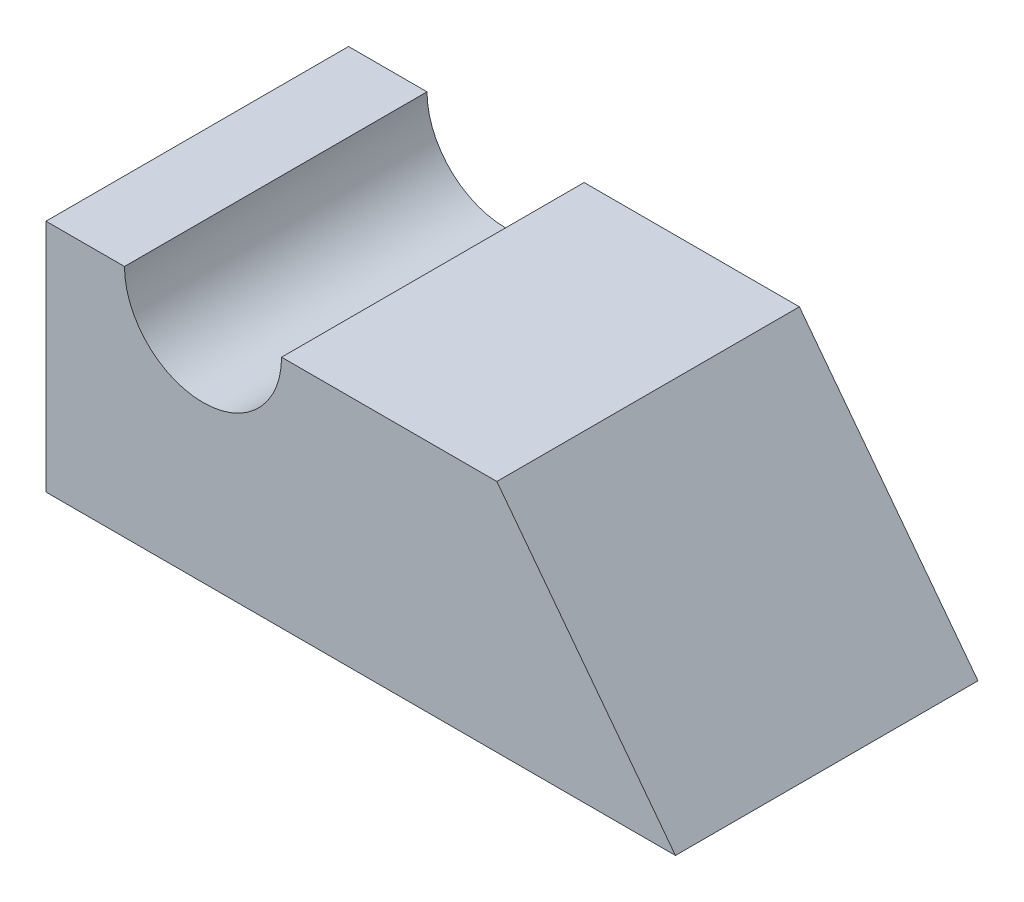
SolidWorks part; units mm, degrees
ref_plane "Front Plane" through (0, 0, 0) normal (0, 0, 1) x (1, 0, 0)
ref_plane "Top Plane" through (0, 0, 0) normal (0, 1, 0) x (1, 0, 0)
ref_plane "Right Plane" through (0, 0, 0) normal (1, 0, 0) x (0, 0, -1)
sketch "Sketch1" plane through (0, 0, 0) normal (0, 0, 1) x (1, 0, 0)
  line L0 (0, 0) -> (95.1235, 0)
  line L1 (95.1235, 0) -> (68.1312, 35.4548)
  line L2 (68.1312, 35.4548) -> (35.5996, 35.4548)
  line L3 (11.8588, 35.4548) -> (0, 35.4548)
  line L4 (0, 35.4548) -> (0, 0)
  arc A0 (35.5996, 35.4548) -> (11.8588, 35.4548) centre (23.7292, 35.4548) cw
extrude "Boss-Extrude1" add sketch "Sketch1" along normal mid plane 45.72
sketch "Sketch2" plane through (0, 35.4548, 0) normal (0, 1, 0) x (1, 0, 0)
  line L0 (68.1312, 0) -> (35.5996, 0)
  line L1 (68.1312, -22.86) -> (68.1312, 22.86) construction
  line L2 (35.5996, -22.86) -> (35.5996, 22.86) construction
